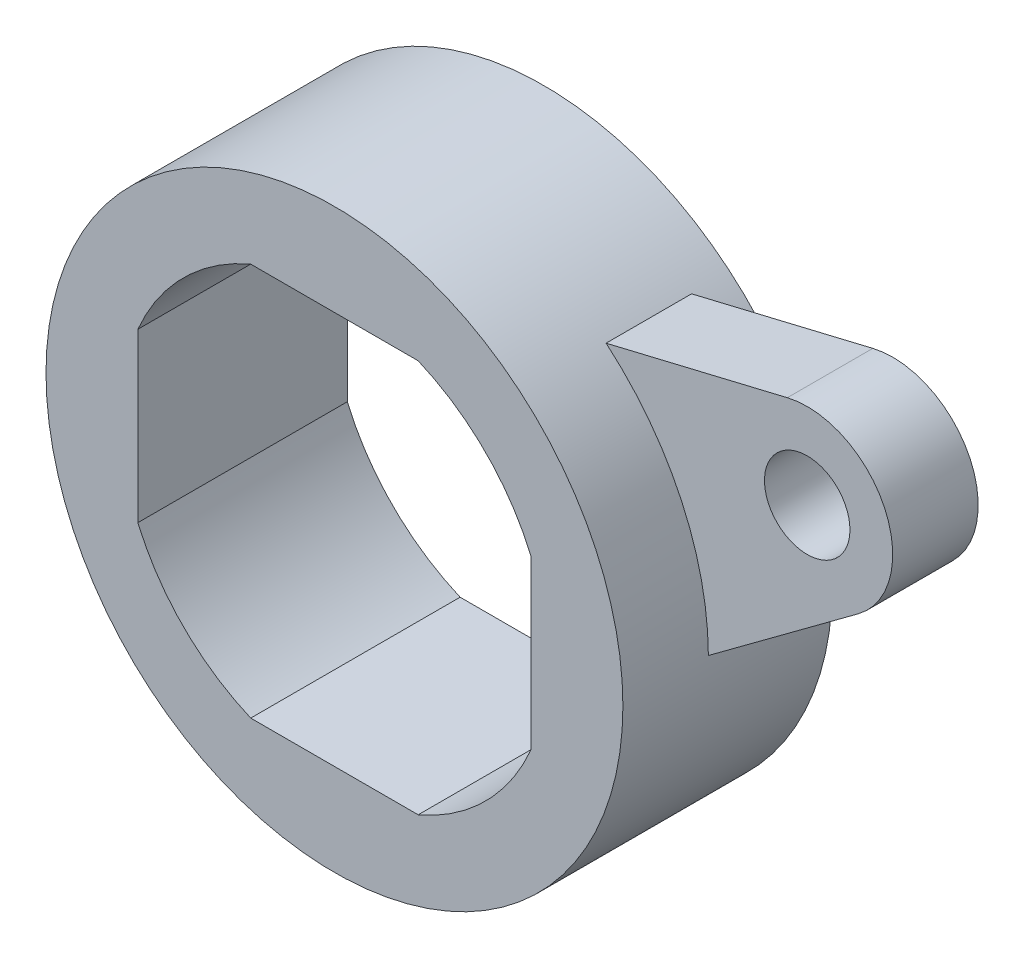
SolidWorks part; units mm, degrees
ref_plane "Front Plane" through (0, 0, 0) normal (0, 0, 1) x (1, 0, 0)
ref_plane "Top Plane" through (0, 0, 0) normal (0, 1, 0) x (1, 0, 0)
ref_plane "Right Plane" through (0, 0, 0) normal (1, 0, 0) x (0, 0, -1)
body saved out of another part "-jempol metakarpal-1"
